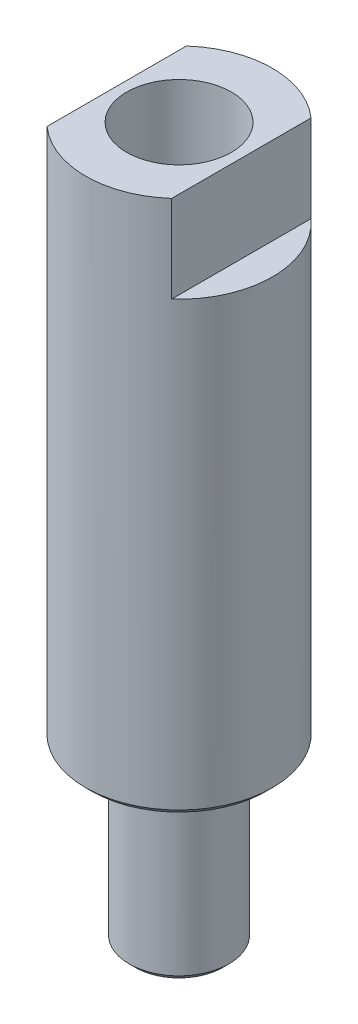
SolidWorks part; units mm, degrees
ref_plane "Front" through (0, 0, 0) normal (0, 0, 1) x (1, 0, 0)
ref_plane "Top" through (0, 0, 0) normal (0, 1, 0) x (1, 0, 0)
ref_plane "Right" through (0, 0, 0) normal (1, 0, 0) x (0, 0, -1)
other "Configuration Table"
sketch "Sketch1" plane through (0, 0, 0) normal (0, 1, 0) x (1, 0, 0)
  circle A0 centre (0, 0) radius 7.5
  dimension "D1" = 15
extrude "Extrude1" add sketch "Sketch1" along normal blind 43
sketch "Sketch2" plane through (0, 0, 0) normal (0, -1, 0) x (1, 0, 0)
  circle A0 centre (0, 0) radius 4
  dimension "D1" = 8
extrude "Extrude2" add sketch "Sketch2" along normal blind 14
sketch "Sketch4" plane through (0, 43, 0) normal (0, 1, 0) x (-1, 0, 0)
  line L0 (5, 5.5902) -> (5, -5.5902)
  line L1 (-5, 5.5902) -> (-5, -5.5902)
  circle A0 centre (0, 0) radius 7.5 construction
  circle A1 centre (0, 0) radius 7.5
  dimension "D1" = 10
extrude "Cut-Extrude1" cut sketch "Sketch4" against normal blind 7 contours L1 M1 | L0 M1
chamfer "Chamfer1" distance 0.5 angle 45 2 edges at (0, -14, -4) (0, 0, 7.5)
sketch "Sketch5" plane through (0, 0, 0) normal (0, 0, 1) x (1, 0, 0)
  line L0 (0, 0) -> (0, 45.4745) construction
  line L1 (0, 43) -> (4.2, 43)
  line L2 (5, 43) -> (-5, 43) construction
  line L3 (4.2, 43) -> (4.2, 25)
  line L4 (4.2, 25) -> (0, 22.4764)
  line L5 (0, 43) -> (0, 22.4764)
  line L6 (0, 43) -> (0, 22.4764)
  dimension "D1" = 4.2
  dimension "D2" = 18
  dimension "D3" = 59
revolve "Cut-Revolve2" cut sketch "Sketch5" angle 360 about L0
